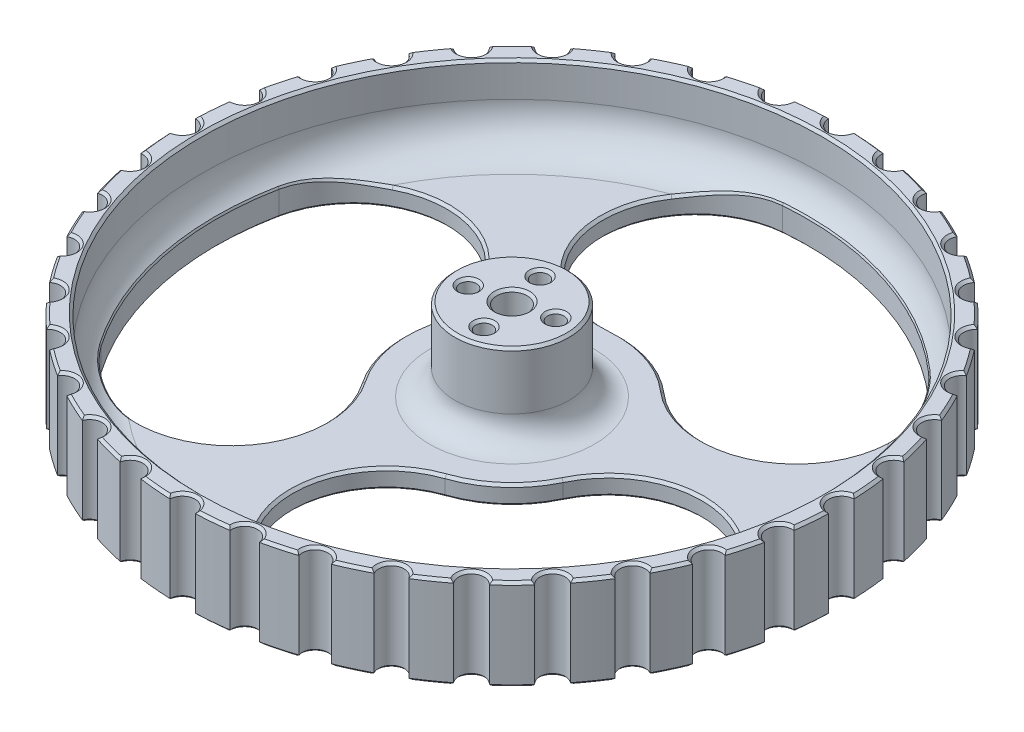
SolidWorks part; units mm, degrees
ref_plane "Plan de face" through (0, 0, 0) normal (0, 0, 1) x (1, 0, 0)
ref_plane "Plan de dessus" through (0, 0, 0) normal (0, 1, 0) x (1, 0, 0)
ref_plane "Plan de droite" through (0, 0, 0) normal (1, 0, 0) x (0, 0, -1)
sketch "Esquisse1" plane through (0, 0, 0) normal (0, 0, 1) x (1, 0, 0)
  line L0 (0, 0) -> (0, 34.8175) construction
  line L1 (-130, 0) -> (-6, 0)
  line L2 (-6, 0) -> (-6, 40)
  line L3 (-6, 40) -> (-22.5, 40)
  line L4 (-22.5, 40) -> (-22.5, 17.5)
  line L5 (-32.5, 7.5) -> (-107.5, 7.5)
  line L6 (-130, 0) -> (-130, 36)
  line L7 (-130, 36) -> (-122.5, 36)
  line L8 (-122.5, 36) -> (-122.5, 22.5)
  arc A0 (-122.5, 22.5) -> (-107.5, 7.5) centre (-107.5, 22.5) ccw
  arc A1 (-22.5, 17.5) -> (-32.5, 7.5) centre (-32.5, 17.5) cw
  dimension "D7" = 15
  dimension "D9" = 10
  dimension "D1" = 12
  dimension "D2" = 45
  dimension "D3" = 260
  dimension "D4" = 36
  dimension "D5" = 7.5
  dimension "D6" = 40
  dimension "D8" = 7.5
revolve "Révolution1" add sketch "Esquisse1" angle 360 about L0
sketch "Esquisse2" plane through (0, 36, 0) normal (0, 1, 0) x (1, 0, 0)
  circle A0 centre (0, 130) radius 5
  circle A1 centre (22.5743, 128.025) radius 5
  circle A2 centre (44.4626, 122.16) radius 5
  circle A3 centre (65, 112.5833) radius 5
  circle A4 centre (83.5624, 99.5858) radius 5
  circle A5 centre (99.5858, 83.5624) radius 5
  circle A6 centre (112.5833, 65) radius 5
  circle A7 centre (122.16, 44.4626) radius 5
  circle A8 centre (128.025, 22.5743) radius 5
  circle A9 centre (130, 0) radius 5
  circle A10 centre (128.025, -22.5743) radius 5
  circle A11 centre (122.16, -44.4626) radius 5
  circle A12 centre (112.5833, -65) radius 5
  circle A13 centre (99.5858, -83.5624) radius 5
  circle A14 centre (83.5624, -99.5858) radius 5
  circle A15 centre (65, -112.5833) radius 5
  circle A16 centre (44.4626, -122.16) radius 5
  circle A17 centre (22.5743, -128.025) radius 5
  circle A18 centre (0, -130) radius 5
  circle A19 centre (-22.5743, -128.025) radius 5
  circle A20 centre (-44.4626, -122.16) radius 5
  circle A21 centre (-65, -112.5833) radius 5
  circle A22 centre (-83.5624, -99.5858) radius 5
  circle A23 centre (-99.5858, -83.5624) radius 5
  circle A24 centre (-112.5833, -65) radius 5
  circle A25 centre (-122.16, -44.4626) radius 5
  circle A26 centre (-128.025, -22.5743) radius 5
  circle A27 centre (-130, 0) radius 5
  circle A28 centre (-128.025, 22.5743) radius 5
  circle A29 centre (-122.16, 44.4626) radius 5
  circle A30 centre (-112.5833, 65) radius 5
  circle A31 centre (-99.5858, 83.5624) radius 5
  circle A32 centre (-83.5624, 99.5858) radius 5
  circle A33 centre (-65, 112.5833) radius 5
  circle A34 centre (-44.4626, 122.16) radius 5
  circle A35 centre (-22.5743, 128.025) radius 5
  arc A36 (-6.4207, 79.2403) -> (52.247, 59.9208) centre (0, 0) cw construction
  arc A37 (76.5632, 87.8085) -> (-9.4089, 116.1194) centre (0, 0) ccw
  arc A38 (27.9308, 32.0331) -> (-3.4324, 42.3612) centre (0, 0) ccw
  arc A39 (27.9308, 32.0331) -> (76.5632, 87.8085) centre (52.247, 59.9208) ccw
  arc A40 (-9.4089, 116.1194) -> (-3.4324, 42.3612) centre (-6.4207, 79.2403) ccw
  arc A41 (71.8344, -34.0597) -> (25.7694, -75.2076) centre (0, 0) cw construction
  arc A42 (37.7628, -110.2099) -> (105.2668, -49.9114) centre (0, 0) ccw
  arc A43 (13.7761, -40.2053) -> (38.4021, -18.208) centre (0, 0) ccw
  arc A44 (13.7761, -40.2053) -> (37.7628, -110.2099) centre (25.7694, -75.2076) ccw
  arc A45 (105.2668, -49.9114) -> (38.4021, -18.208) centre (71.8344, -34.0597) ccw
  arc A46 (-65.4138, -45.1806) -> (-78.0164, 15.2868) centre (0, 0) cw construction
  arc A47 (-114.326, 22.4014) -> (-95.8579, -66.2081) centre (0, 0) ccw
  arc A48 (-41.7069, 8.1722) -> (-34.9696, -24.1532) centre (0, 0) ccw
  arc A49 (-41.7069, 8.1722) -> (-114.326, 22.4014) centre (-78.0164, 15.2868) ccw
  arc A50 (-95.8579, -66.2081) -> (-34.9696, -24.1532) centre (-65.4138, -45.1806) ccw
  circle A51 centre (0, 0) radius 22.5 construction
  circle A52 centre (-3.1001, 14.1647) radius 3.25
  circle A53 centre (14.1647, 3.1001) radius 3.25
  circle A54 centre (3.1001, -14.1647) radius 3.25
  circle A55 centre (-14.1647, -3.1001) radius 3.25
  circle A56 centre (0, 0) radius 122.5 construction
  point P75 (0, 0)
  point P78 (24.8661, 75.5111)
  point P87 (52.9615, -59.2902)
  point P94 (-77.8276, -16.2209)
  point P99 (0, 0)
  point P110 (0, 0)
  dimension "D1" = 10
  dimension "D3" = 36
  dimension "D5" = 20
  dimension "D6" = 6
  dimension "D8" = 29
  dimension "D9" = 6.5
  dimension "D2" = 130
  dimension "D10" = 96
  dimension "D4" = 3
  dimension "D7" = 4
extrude "Enlèv. mat.-Extru.1" cut sketch "Esquisse2" against normal through all both and the other way through all
sketch "Esquisse3" plane through (0, 0, 0) normal (0, -1, 0) x (1, 0, 0)
  line L1 (-11.1429, 0) -> (-5.5714, -9.65)
  line L2 (-5.5714, -9.65) -> (5.5714, -9.65)
  line L3 (5.5714, -9.65) -> (11.1429, 0)
  line L4 (11.1429, 0) -> (5.5714, 9.65)
  line L5 (5.5714, 9.65) -> (-5.5714, 9.65)
  line L6 (-5.5714, 9.65) -> (-11.1429, 0)
  circle A0 centre (0, 0) radius 9.65 construction
  dimension "D1" = 19.3
extrude "Enlèv. mat.-Extru.2" cut sketch "Esquisse3" against normal blind 8
chamfer "Chanfrein1" distance 1 angle 45 191 edges at (-62.5, 0, 108.2532) (-54.9404, 0, 117.82) (-42.7525, 0, 117.4616) (-33.6465, 0, 125.5704) (-21.706, 0, 123.101) (-11.3302, 0, 129.5053) (0, 0, 125) (11.3302, 0, 129.5053) (21.706, 0, 123.101) (33.6465, 0, 125.5704) (42.7525, 0, 117.4616) (54.9404, 0, 117.82) (62.5, 0, 108.2532) (74.5649, 0, 106.4898) (80.3485, 0, 95.7556) (91.9239, 0, 91.9239) (95.7556, 0, 80.3485) (106.4898, 0, 74.5649) (108.2532, 0, 62.5) (117.82, 0, 54.9404) (117.4616, 0, 42.7525) (125.5704, 0, 33.6465) (123.101, 0, 21.706) (129.5053, 0, 11.3302) (125, 0, 0) (129.5053, 0, -11.3302) (123.101, 0, -21.706) (125.5704, 0, -33.6465) (117.4616, 0, -42.7525) (117.82, 0, -54.9404) (108.2532, 0, -62.5) (106.4898, 0, -74.5649) (95.7556, 0, -80.3485) (91.9239, 0, -91.9239) (80.3485, 0, -95.7556) (74.5649, 0, -106.4898) (62.5, 0, -108.2532) (54.9404, 0, -117.82) (42.7525, 0, -117.4616) (33.6465, 0, -125.5704) (21.706, 0, -123.101) (11.3302, 0, -129.5053) (0, 0, -125) (-11.3302, 0, -129.5053) (-21.706, 0, -123.101) (-33.6465, 0, -125.5704) (-42.7525, 0, -117.4616) (-54.9404, 0, -117.82) (-62.5, 0, -108.2532) (-74.5649, 0, -106.4898) (-80.3485, 0, -95.7556) (-91.9239, 0, -91.9239) (-95.7556, 0, -80.3485) (-106.4898, 0, -74.5649) (-108.2532, 0, -62.5) (-117.82, 0, -54.9404) (-117.4616, 0, -42.7525) (-125.5704, 0, -33.6465) (-123.101, 0, -21.706) (-129.5053, 0, -11.3302) (-125, 0, 0) (-129.5053, 0, 11.3302) (-123.101, 0, 21.706) (-125.5704, 0, 33.6465) (-117.4616, 0, 42.7525) (-117.82, 0, 54.9404) (-108.2532, 0, 62.5) (-106.4898, 0, 74.5649) (-95.7556, 0, 80.3485) (-91.9239, 0, 91.9239) (-80.3485, 0, 95.7556) (-74.5649, 0, 106.4898) (-43.2998, 0, -76.2521) (36.439, 0, -110.6546) (80.1347, 0, -35.6046) (13.2932, 0, -40.3676) (-14.1647, 0, 6.3501) (3.1001, 0, 17.4147) (14.1647, 0, 0.1499) (87.6861, 0, 0.6273) (77.6102, 0, 86.8844) (-9.2328, 0, 87.2009) (28.3127, 0, 31.696) (-44.3863, 0, 75.6248) (-114.0492, 0, 23.7702) (-70.9018, 0, -51.5963) (-41.6059, 0, 8.6715) (-3.1001, 0, -10.9147) (0, 36, -122.5) (-95.7556, 36, 80.3485) (-106.4898, 36, 74.5649) (-108.2532, 36, 62.5) (-117.82, 36, 54.9404) (-117.4616, 36, 42.7525) (-125.5704, 36, 33.6465) (-123.101, 36, 21.706) (-129.5053, 36, 11.3302) (-125, 36, 0) (-129.5053, 36, -11.3302) (-123.101, 36, -21.706) (-125.5704, 36, -33.6465) (-117.4616, 36, -42.7525) (-117.82, 36, -54.9404) (-108.2532, 36, -62.5) (-106.4898, 36, -74.5649) (-95.7556, 36, -80.3485) (-91.9239, 36, -91.9239) (-80.3485, 36, -95.7556) (-74.5649, 36, -106.4898) (-62.5, 36, -108.2532) (-54.9404, 36, -117.82) (-42.7525, 36, -117.4616) (-33.6465, 36, -125.5704) (-21.706, 36, -123.101) (-11.3302, 36, -129.5053) (0, 36, -125) (11.3302, 36, -129.5053) (21.706, 36, -123.101) (33.6465, 36, -125.5704) (42.7525, 36, -117.4616) (54.9404, 36, -117.82) (62.5, 36, -108.2532) (74.5649, 36, -106.4898) (80.3485, 36, -95.7556) (91.9239, 36, -91.9239) (95.7556, 36, -80.3485) (106.4898, 36, -74.5649) (108.2532, 36, -62.5) (117.82, 36, -54.9404) (117.4616, 36, -42.7525) (125.5704, 36, -33.6465) (123.101, 36, -21.706) (129.5053, 36, -11.3302) (125, 36, 0) (129.5053, 36, 11.3302) (123.101, 36, 21.706) (125.5704, 36, 33.6465) (117.4616, 36, 42.7525) (117.82, 36, 54.9404) (108.2532, 36, 62.5) (106.4898, 36, 74.5649) (95.7556, 36, 80.3485) (91.9239, 36, 91.9239) (80.3485, 36, 95.7556) (74.5649, 36, 106.4898) (62.5, 36, 108.2532) (54.9404, 36, 117.82) (42.7525, 36, 117.4616) (33.6465, 36, 125.5704) (21.706, 36, 123.101) (11.3302, 36, 129.5053) (0, 36, 125) (-11.3302, 36, 129.5053) (-21.706, 36, 123.101) (-33.6465, 36, 125.5704) (-42.7525, 36, 117.4616) (-54.9404, 36, 117.82) (-62.5, 36, 108.2532) (-74.5649, 36, 106.4898) (-80.3485, 36, 95.7556) (-91.9239, 36, 91.9239) (0, 40, -6) (0, 40, -22.5) (-14.1647, 40, 6.3501) (3.1001, 40, 17.4147) (14.1647, 40, 0.1499) (-3.1001, 40, -10.9147) (77.6102, 10.5, 86.8844) (26.6731, 9.7019, 112.1966) (108.7883, 9.2659, 35.9078) (-11.0578, 7.5, 71.6366) (72.4255, 7.5, -2.9356) (28.3127, 7.5, 31.696) (83.8285, 9.7019, -79.1979) (67.568, 7.5, -26.2419) (36.439, 10.5, -110.6546) (13.2932, 7.5, -40.3676) (-23.297, 9.2659, -112.1673) (-38.7551, 7.5, -61.2546) (-85.4912, 9.2659, 76.2595) (-114.0492, 10.5, 23.7702) (-33.6705, 7.5, 64.1902) (-110.5021, 9.702, -32.9979) (-41.6059, 7.5, 8.6715) (-56.5102, 7.5, -45.3947) (0, 0, -9.65) (8.3571, 0, -4.825) (8.3571, 0, 4.825) (0, 0, 9.65) (-8.3571, 0, 4.825) (-8.3571, 0, -4.825)
chamfer "Chanfrein4" distance 5 angle 45 1 edges at (0, 8, -6)
